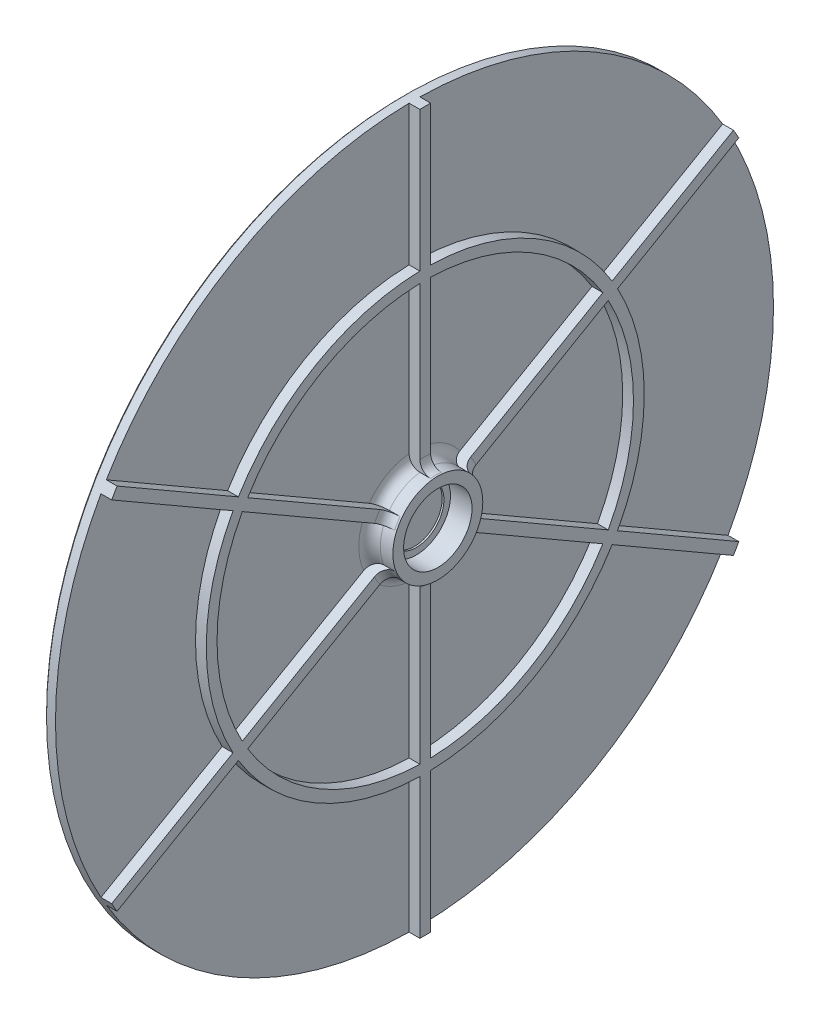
SolidWorks part; units mm, degrees
ref_plane "Alzado" through (0, 0, 0) normal (0, 0, 1) x (1, 0, 0)
ref_plane "Planta" through (0, 0, 0) normal (0, 1, 0) x (1, 0, 0)
ref_plane "Vista lateral" through (0, 0, 0) normal (1, 0, 0) x (0, 0, -1)
sketch "Croquis1" plane through (0, 0, 0) normal (0, 0, 1) x (1, 0, 0)
  line L0 (0, 0) -> (0, 100)
  line L1 (0, 100) -> (3, 100)
  line L2 (3, 100) -> (3, 61)
  line L3 (3, 12.525) -> (9.5, 12.525)
  line L4 (9.5, 12.525) -> (9.5, 9.525)
  line L5 (9.5, 9.525) -> (3.5, 9.525)
  line L6 (3.5, 9.525) -> (3.5, 7.7)
  line L7 (3.5, 7.7) -> (3, 7.7)
  line L8 (3, 7.7) -> (3, 0)
  line L9 (3, 0) -> (0, 0) construction
  line L10 (0, 0) -> (3, 0)
  line L11 (3, 58) -> (3, 12.525)
  line L12 (3, 61) -> (6, 61)
  line L14 (3, 58) -> (6, 58)
  line L15 (6, 61) -> (6, 58)
  dimension "D1" = 3
  dimension "D2" = 200
  dimension "D3" = 19.05
  dimension "D4" = 0.5
  dimension "D5" = 15.4
  dimension "D6" = 6
  dimension "D7" = 3
  dimension "D8" = 3
  dimension "D9" = 3
  dimension "D10" = 39
revolve "Revolución1" add sketch "Croquis1" angle 360 about L9
sketch "Croquis4" plane through (3, 0, 0) normal (1, 0, 0) x (0, 0, -1)
  line L0 (0, 0) -> (0, 100) construction
  line L1 (1.5, 12.4349) -> (1.5, 99.9887)
  line L2 (-1.5, 12.4349) -> (-1.5, 99.9887)
  line L4 (1.5, 0) -> (1.5, 100) construction
  line L5 (-1.5, 0) -> (-1.5, 100) construction
  circle A0 centre (0, 0) radius 100 construction
  circle A1 centre (0, 0) radius 12.525 construction
  arc A2 (1.5, 12.4349) -> (-1.5, 12.4349) centre (0, 0) ccw
  arc A3 (1.5, 99.9887) -> (-1.5, 99.9887) centre (0, 0) ccw
  dimension "D1" = 1.5
  dimension "D2" = 1.5
extrude "Saliente-Extruir1" add sketch "Croquis4" along normal blind 3
pattern_circular "MatrizC1" count 6 every 60 about axis through (0, 0, 0) along (1, 0, 0) of "Saliente-Extruir1"
fillet "Redondeo1" radius 3 12 edges at (3, 0, 12.525) (3, -10.847, 6.2625) (3, -10.847, -6.2625) (3, 0, -12.525) (3, 10.847, -6.2625) (3, 10.847, 6.2625) (6, 6.2625, 10.847) (6, 12.525, 0) (6, 6.2625, -10.847) (6, -6.2625, -10.847) (6, -12.525, 0) (6, -6.2625, 10.847)
chamfer "Chaflán1" distance 0.5 angle 45 1 edges at (0, 0, -100)
